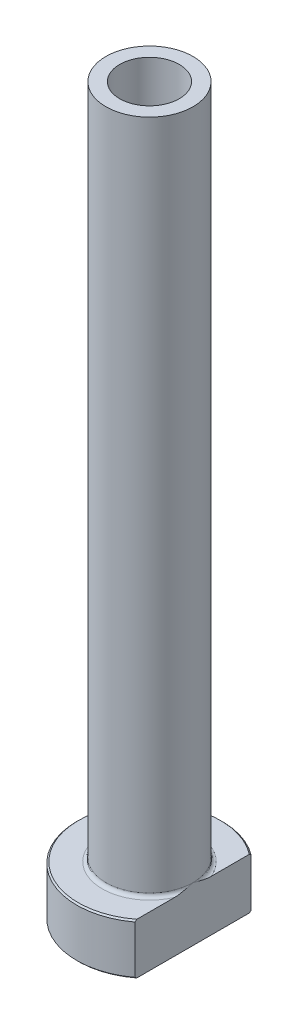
SolidWorks part; units mm, degrees
ref_plane "Front Plane" through (0, 0, 0) normal (0, 0, 1) x (1, 0, 0)
ref_plane "Top Plane" through (0, 0, 0) normal (0, 1, 0) x (1, 0, 0)
ref_plane "Right Plane" through (0, 0, 0) normal (1, 0, 0) x (0, 0, -1)
sketch "Sketch1" plane through (0, 0, 0) normal (0, 0, 1) x (1, 0, 0)
  line L0 (-4.1, 100) -> (-6, 100)
  line L1 (-6, 100) -> (-6, 7)
  line L2 (-6, 7) -> (-10, 7)
  line L3 (-10, 7) -> (-10, 0)
  line L4 (7.15, 0) -> (-7.15, 0) construction
  line L5 (-10, 0) -> (-4.35, 0)
  line L6 (-4.1, 55) -> (-4.1, 100)
  line L7 (0, 92.1877) -> (0, -15.5353) construction
  line L8 (0, -8.8) -> (0, 8.8) construction
  line L9 (-4.1, 55) -> (-4.35, 43)
  line L10 (-4.35, 43) -> (-4.35, 0)
  dimension "D1" = 0.25
  dimension "ID" = 8.2
  dimension "OD" = 12
  dimension "L" = 100
  dimension "H" = 20
  dimension "T" = 7
  dimension "N" = 45
  dimension "D2" = 12
  dimension "L-N" = 55
revolve "Revolve1" add sketch "Sketch1" angle 360 about L7
fillet "Fillet1" radius 0.5 1 edges at (0, 7, 6)
chamfer "Chamfer1" distance 0.2 angle 45 2 edges at (0, 7, 10) (0, 0, 10)
sketch "Sketch2" plane through (0, 0, 0) normal (0, -1, 0) x (1, 0, 0)
  line L0 (6, 8) -> (6, -8)
  circle A0 centre (0, 0) radius 10 construction
  arc A1 (6, 8) -> (6, -8) centre (0, 0) cw
  circle A2 centre (0, 0) radius 6 construction
extrude "Cut-Extrude1" cut sketch "Sketch2" against normal through all
chamfer "Chamfer2" distance 0.5 angle 45 1 edges at (0, 0, 4.35)
